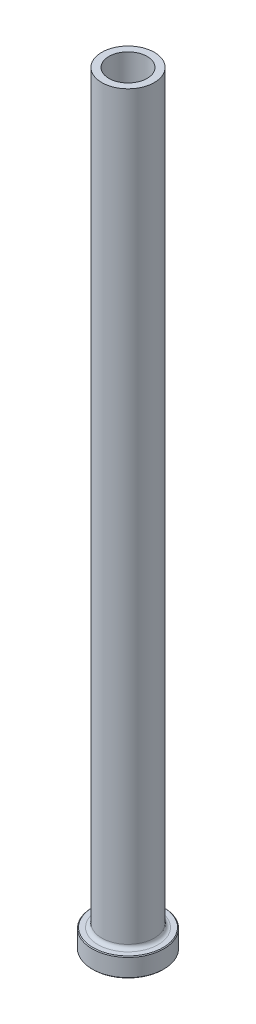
SolidWorks part; units mm, degrees
ref_plane "Front Plane" through (0, 0, 0) normal (0, 0, 1) x (1, 0, 0)
ref_plane "Top Plane" through (0, 0, 0) normal (0, 1, 0) x (1, 0, 0)
ref_plane "Right Plane" through (0, 0, 0) normal (1, 0, 0) x (0, 0, -1)
sketch "Sketch1" plane through (0, 0, 0) normal (0, 0, 1) x (1, 0, 0)
  line L0 (0, 0) -> (0, 50000) construction
  line L1 (0, 0) -> (11.8999, 0)
  line L2 (11.8999, 0) -> (11.8999, 6.35)
  line L3 (11.8999, 6.35) -> (9.9949, 6.35)
  line L4 (8.7249, 7.62) -> (8.7249, 254)
  line L5 (8.7249, 254) -> (0, 254)
  line L6 (0, 254) -> (0, 0)
  arc A0 (8.7249, 7.62) -> (9.9949, 6.35) centre (9.9949, 7.62) ccw
  dimension "D5" = 1.27
  dimension "D1" = 17.4498
  dimension "D2" = 23.7998
  dimension "D3" = 6.35
  dimension "D4" = 254
revolve "Revolve1" add sketch "Sketch1" angle 360 about L0
sketch "Sketch2" plane through (0, 0, 0) normal (0, 0, 1) x (1, 0, 0)
  line L0 (0, 0) -> (0, 50000) construction
  line L1 (-11.8999, 0) -> (11.8999, 0) construction
  line L2 (6.9374, 0) -> (6.5405, 0.3969)
  line L3 (6.5405, 0.3969) -> (6.5405, 179.5145)
  line L4 (6.5405, 179.5145) -> (6.35, 193.802)
  line L5 (6.35, 193.802) -> (6.35, 254)
  line L6 (8.7249, 254) -> (-8.7249, 254) construction
  line L7 (6.35, 254) -> (0, 254)
  line L8 (0, 254) -> (0, 0)
  line L9 (0, 0) -> (6.9374, 0)
  point P4 (0, 0)
  dimension "D1" = 0.3969
  dimension "D2" = 45
  dimension "D3" = 12.7
  dimension "D4" = 13.081
  dimension "D5" = 60.198
  dimension "D6" = 14.2875
revolve "Cut-Revolve1" cut sketch "Sketch2" angle 360 about L0
chamfer "Chamfer1" distance 0.254 angle 45 2 edges at (0, 0, -11.8999) (0, 6.35, -11.8999)
